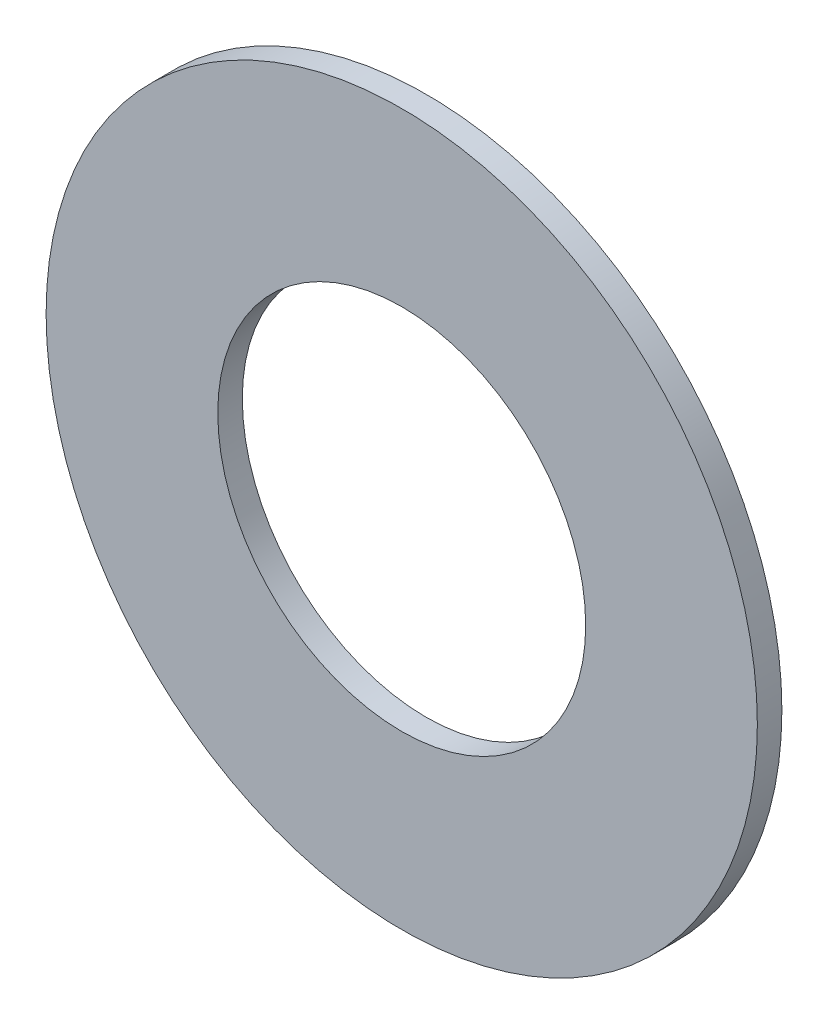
SolidWorks part; units mm, degrees
ref_plane "Front Plane" through (0, 0, 0) normal (1, 0, 0) x (0, 1, 0)
ref_plane "Top Plane" through (0, 0, 0) normal (0, 0, 1) x (0, 1, 0)
ref_plane "Right Plane" through (0, 0, 0) normal (0, 1, 0) x (-1, 0, 0)
sketch "sk 3.5in Nut"
sketch_block_instance "3.5in nut-1"
sketch_block "3.5in nut"
sketch "sk 3.0in nut"
sketch_block_instance "3.0in nut-1"
sketch_block "3.0in nut" parameters "D1"=76.2, "D2"=115.57
sketch "sk 2.25in nut"
  circle A2 centre (0, 0) radius 50.5052
sketch_block_instance "2.25in nut-1"
sketch_block "2.25in nut" parameters "D1"=57.15, "D2"=87.4776
sketch "sk 1.75in nut"
  circle A2 centre (0, 0) radius 39.6827
sketch_block_instance "1.75in nut-1"
sketch_block "1.75in nut" parameters "D1"=44.45, "D2"=68.7324
sketch "Sketch2" plane through (0, 0, 0) normal (0, 0, 1) x (0, 1, 0)
  circle A2 centre (0, 0) radius 23.8125
  circle A6 centre (0, 0) radius 46.0327
  circle A8 centre (0, 0) radius 46.0327
  dimension "D2" = 47.625
  dimension "D1" = 6.35
extrude "Boss-Extrude1" add sketch "Sketch2" along normal mid plane 3.175
